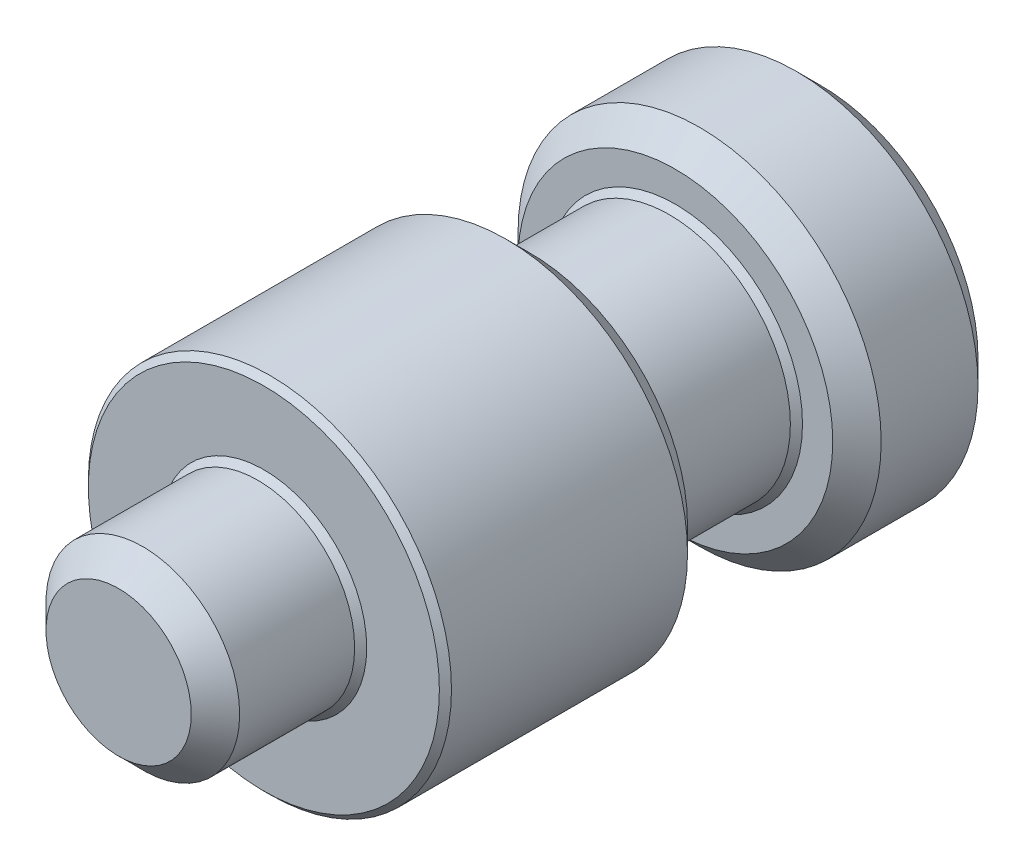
SolidWorks part; units mm, degrees
ref_plane "Спереди" through (0, 0, 0) normal (0, 0, 1) x (1, 0, 0)
ref_plane "Сверху" through (0, 0, 0) normal (0, 1, 0) x (1, 0, 0)
ref_plane "Справа" through (0, 0, 0) normal (1, 0, 0) x (0, 0, -1)
sketch "Эскиз1" plane through (0, 0, 0) normal (0, 0, 1) x (1, 0, 0)
  circle A0 centre (0, 0) radius 7.5
  dimension "D1" = 15
extrude "Бобышка-Вытянуть1" add sketch "Эскиз1" along normal blind 6
sketch "Эскиз2" plane through (0, 0, 6) normal (0, 0, 1) x (1, 0, 0)
  circle A0 centre (0, 0) radius 5
  dimension "D1" = 10
extrude "Бобышка-Вытянуть2" add sketch "Эскиз2" along normal blind 6
sketch "Эскиз3" plane through (0, 0, 12) normal (0, 0, 1) x (1, 0, 0)
  circle A0 centre (0, 0) radius 7.5 construction
  circle A1 centre (0, 0) radius 7.5
extrude "Бобышка-Вытянуть3" add sketch "Эскиз3" along normal blind 11
sketch "Эскиз4" plane through (0, 0, 23) normal (0, 0, 1) x (1, 0, 0)
  circle A0 centre (0, 0) radius 4
  dimension "D1" = 8
extrude "Бобышка-Вытянуть4" add sketch "Эскиз4" along normal blind 6
chamfer "Фаска1" distance 1 angle 45 4 edges at (4, 0, 29) (7.5, 0, 12) (7.5, 0, 6) (7.5, 0, 0)
chamfer "Фаска2" distance 0.25 angle 45 4 edges at (4, 0, 23) (7.5, 0, 23) (5, 0, 6) (5, 0, 12)
